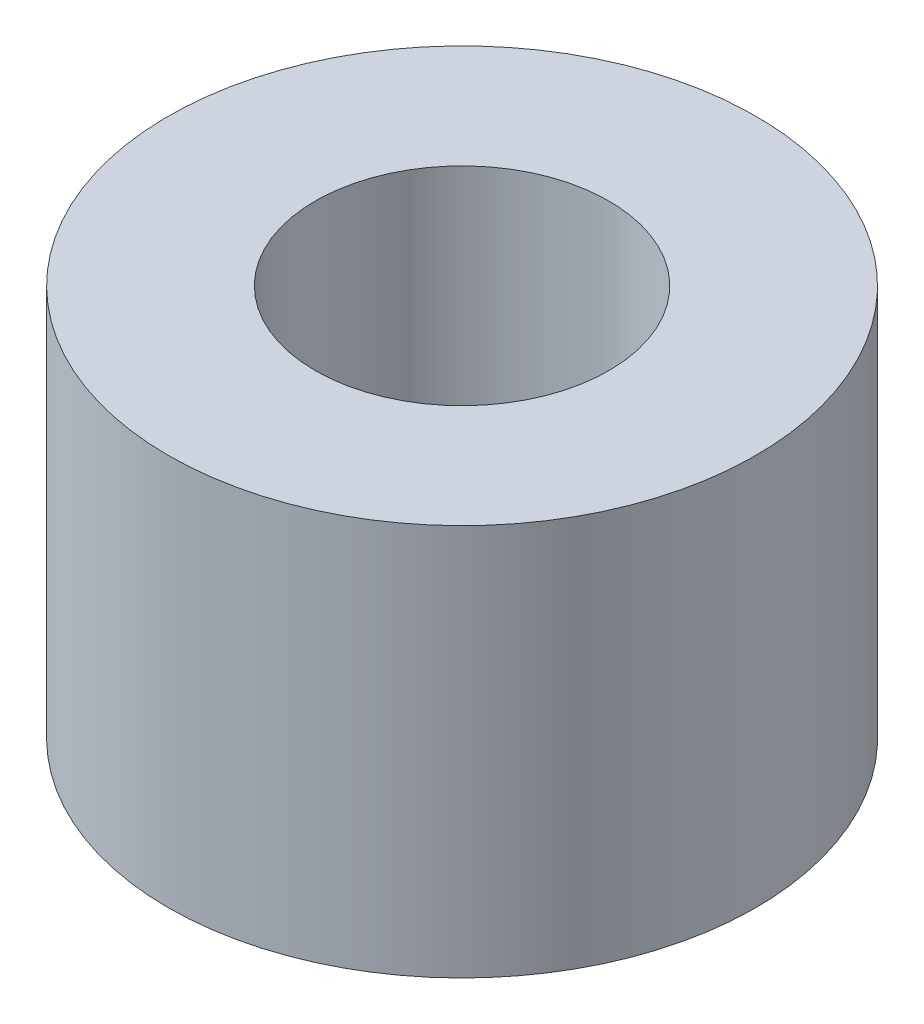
SolidWorks part; units mm, degrees
ref_plane "Front" through (0, 0, 0) normal (0, 0, 1) x (1, 0, 0)
ref_plane "Top" through (0, 0, 0) normal (0, 1, 0) x (1, 0, 0)
ref_plane "Right" through (0, 0, 0) normal (1, 0, 0) x (0, 0, -1)
sketch "草图3" plane through (0, 0, 0) normal (0, 1, 0) x (1, 0, 0)
  circle A0 centre (0, 0) radius 3
  circle A1 centre (0, 0) radius 1.5
  dimension "D1" = 6
  dimension "D2" = 3
extrude "凸台-拉伸2" add sketch "草图3" along normal blind 4
